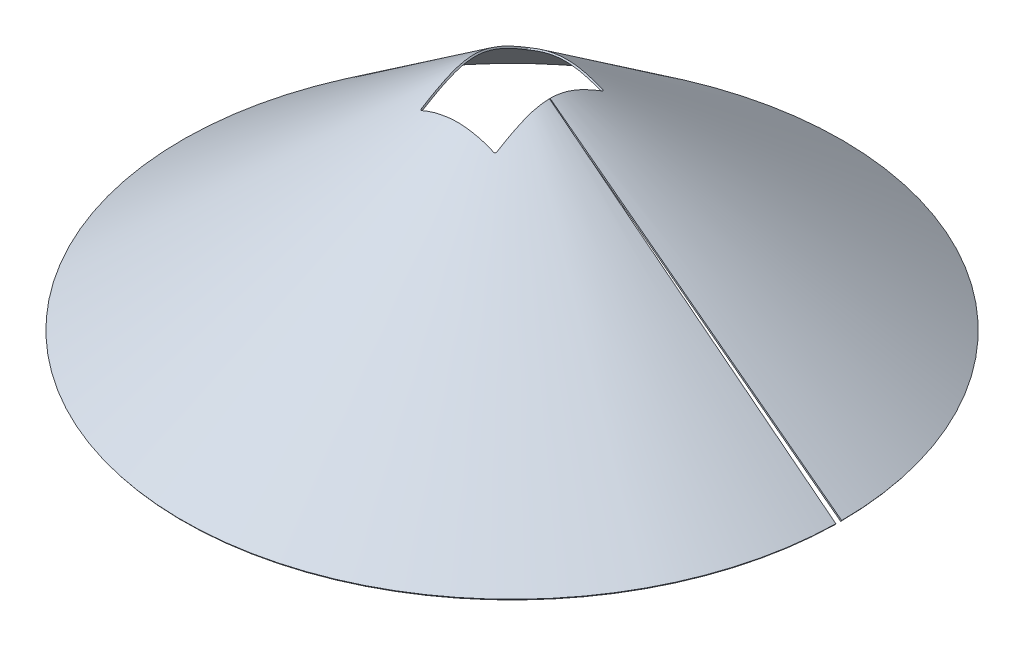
SolidWorks part; units mm, degrees
ref_plane "Ebene vorne" through (0, 0, 0) normal (0, 0, 1) x (1, 0, 0)
ref_plane "Ebene oben" through (0, 0, 0) normal (0, 1, 0) x (1, 0, 0)
ref_plane "Ebene rechts" through (0, 0, 0) normal (1, 0, 0) x (0, 0, -1)
sketch "Skizze1" plane through (0, 0, 0) normal (0, 0, 1) x (1, 0, 0)
  line L0 (0, 0) -> (0, 424.4714) construction
  line L1 (1, 150) -> (200, 0)
  dimension "D1" = 400
  dimension "D2" = 2
  dimension "D3" = 150
sketch "Skizze2" plane through (0, 0, 0) normal (0, 1, 0) x (1, 0, 0)
  line L0 (0, 70.3169) -> (0, 0) construction
  line L1 (-22.5, 32.5) -> (22.5, 32.5)
  line L2 (-22.5, 32.5) -> (-22.5, -32.5)
  line L3 (-22.5, -32.5) -> (22.5, -32.5)
  line L4 (22.5, 32.5) -> (22.5, -32.5)
  line L5 (0, 0) -> (-84.3803, 0) construction
  dimension "D1" = 45
  dimension "D2" = 65
revolve "Rotation-Dünn1" add sketch "Skizze1" angle 359 about L0
extrude "Schnitt-Linear austragen1" cut sketch "Skizze2" along normal through all
fillet "Verrundung1" radius 1 4 edges at (22.5, 120.3323, 32.5) (-22.5, 120.3323, 32.5) (-22.5, 120.3323, -32.5) (22.5, 120.3323, -32.5)
sheet metal parameters "Blech1" parameters "D1"=1, "Dicke"=1
bend "Biegung-Rundung1" bend radius 0.3981 bend angle 359 parameters "D5"=1
flatten bends "Abwickeln1" parameters "D1"=0
sketch "Skizze-Winkel1" plane through (110.949, 65.8716, 0) normal (-0.6019, -0.7986, 0) x (0.7986, -0.6019, 0)
  line L0 (-162.8987, -17.2728) -> (-340.6036, -149.5358) construction
process bends "Abbiegen1" parameters "D1"=0
sketch "Abwicklung-Skizze1" plane through (71.8607, 95.3352, 0) normal (-0.6019, -0.7986, 0) x (0.7986, -0.6019, 0)
equation "\"LÄNGE\"=0"
equation "\"BREITE\"=0"
equation "\"HÖHE\"=0"
equation "\"DURCHMESSER\"=0"
equation "\"Stückzahl\"= 1"
